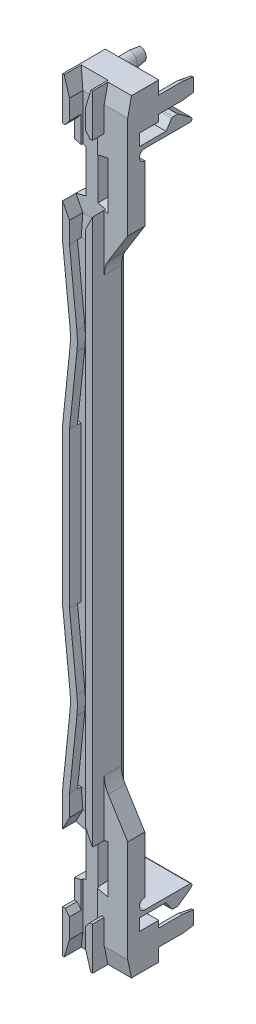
SolidWorks part; units mm, degrees
ref_plane "前视基准面" through (0, 0, 0) normal (0, 0, 1) x (1, 0, 0)
ref_plane "上视基准面" through (0, 0, 0) normal (0, 1, 0) x (1, 0, 0)
ref_plane "右视基准面" through (0, 0, 0) normal (1, 0, 0) x (0, 0, -1)
sketch "草图1" plane through (0, 0, 0) normal (0, 0, 1) x (1, 0, 0)
  line L0 (3.4, 59.5) -> (-6.6, 59.5) construction
  line L1 (-0.25, -0.4) -> (-0.25, 8.6)
  line L2 (-2.45, 110.9) -> (-2.45, 118.9)
  line L4 (3.4, 108.6) -> (3.4, 131)
  line L5 (-4.7, 110.9) -> (-4.7, 118.9)
  line L6 (-6.6, 131) -> (-6.6, 119.4)
  line L7 (-1, 101.5) -> (3.4, 108.6)
  line L8 (-0.25, 110.4) -> (-2.45, 110.9)
  line L9 (-6.6, 110.4) -> (-4.7, 110.9)
  line L10 (-6.6, 119.4) -> (-4.7, 118.9)
  line L11 (-0.25, 119.4) -> (-2.45, 118.9)
  line L13 (-0.25, 119.4) -> (-0.25, 110.4)
  line L26 (3.4, -12) -> (-6.6, -12)
  line L27 (-0.25, -0.4) -> (-2.45, 0.1)
  line L28 (-6.6, -0.4) -> (-4.7, 0.1)
  line L29 (-6.6, 8.6) -> (-4.7, 8.1)
  line L30 (-0.25, 8.6) -> (-2.45, 8.1)
  line L31 (-1, 17.5) -> (3.4, 10.4)
  line L32 (-6.6, -12) -> (-6.6, -0.4)
  line L33 (-6.6, 8.6) -> (-6.6, 110.4)
  line L34 (-4.7, 8.1) -> (-4.7, 0.1)
  line L35 (-1, 101.5) -> (-1, 17.5)
  line L37 (3.4, 10.4) -> (3.4, -12)
  line L39 (-2.45, 8.1) -> (-2.45, 0.1)
  line L40 (3.4, 131) -> (-6.6, 131)
  point P12 (-1, 59.5)
  dimension "D2" = 11.6
  dimension "D3" = 10
  dimension "D4" = 22.4
  dimension "D5" = 143
  dimension "D6" = 11.6
  dimension "D7" = 9
  dimension "D8" = 10
  dimension "D9" = 8
  dimension "D10" = 6.35
  dimension "D11" = 9
  dimension "D12" = 2.2
  dimension "D13" = 2.25
  dimension "D14" = 8
  dimension "D15" = 29.5
  dimension "D16" = 5.6
extrude "凸台-拉伸1" add sketch "草图1" against normal blind 5.8
sketch "草图2" plane through (-6.6, 0, 0) normal (-1, 0, 0) x (0, 0, 1)
  line L1 (-5.8, 110.9) -> (-4, 110.9)
  line L2 (-5.8, 110.9) -> (-5.8, 8.1)
  line L3 (-5.8, 8.1) -> (-4, 8.1)
  line L4 (-4, 110.9) -> (-4, 8.1)
  line L6 (-5.8, 8.1) -> (0, 8.1) construction
  line L7 (-5.8, 118.9) -> (-5.8, 110.9) construction
  line L8 (-5.8, 110.9) -> (0, 110.9) construction
  dimension "D1" = 1.8
extrude "切除-拉伸1" cut sketch "草图2" against normal up to surface (1.9 mm away)
sketch "草图3" plane through (3.4, 0, 0) normal (1, 0, 0) x (0, 0, -1)
  line L0 (0, 59.5) -> (5.8, 59.5) construction
  line L1 (0, 17.5) -> (0, 101.5) construction
  line L2 (5.8, 17.5) -> (5.8, 101.5) construction
  line L3 (5.8, 121.2) -> (3.2, 121.2)
  line L5 (5.8, 119.2) -> (3.2, 119.2)
  line L6 (5.8, 121.2) -> (5.8, 119.2)
  line L7 (5.8, 124.2) -> (2.2, 124.2)
  line L8 (5.8, 122.2) -> (2.2, 122.2)
  line L9 (5.8, 124.2) -> (5.8, 122.2)
  line L12 (2.2, -1.2) -> (2.2, -2.0165) construction
  line L13 (2.2, -5.2) -> (2.2, -3.2)
  line L14 (5.8, -5.2) -> (5.8, -3.2)
  line L15 (5.8, -3.2) -> (2.2, -3.2)
  line L16 (5.8, 108.6) -> (5.8, 131) construction
  line L18 (5.8, 131) -> (0, 131) construction
  line L19 (2.2, 124.2) -> (2.2, 122.2)
  line L21 (2.2, 120.2) -> (2.2, 121.0165) construction
  line L22 (5.8, -5.2) -> (2.2, -5.2)
  line L23 (5.8, -2.2) -> (5.8, -0.2)
  line L24 (5.8, -0.2) -> (3.2, -0.2)
  line L25 (5.8, -2.2) -> (3.2, -2.2)
  arc A0 (3.2, 121.2) -> (3.2, 119.2) centre (3.2, 120.2) ccw
  arc A1 (3.2, -2.2) -> (3.2, -0.2) centre (3.2, -1.2) cw
  dimension "D3" = 2
  dimension "D4" = 1
  dimension "D5" = 3.6
  dimension "D7" = 3.6
  dimension "D1" = 6.8
  dimension "D2" = 2
  dimension "D6" = 2
  dimension "D9" = 1
extrude "切除-拉伸2" cut sketch "草图3" against normal through all
sketch "草图4" plane through (3.4, 0, 0) normal (1, 0, 0) x (0, 0, -1)
  line L1 (3.2, 121.2) -> (5.8, 121.2)
  line L2 (3.2, 121.2) -> (3.2, -2.2)
  line L3 (3.2, -2.2) -> (5.8, -2.2)
  line L4 (5.8, 121.2) -> (5.8, -2.2)
  line L5 (5.8, 108.6) -> (5.8, 119.2) construction
  line L8 (5.8, 121.2) -> (3.2, 121.2) construction
  line L9 (3.2, -2.2) -> (5.8, -2.2) construction
  dimension "D1" = 2.6
extrude "切除-拉伸3" cut sketch "草图4" against normal blind 10
sketch "草图5" plane through (0, 0, -5.8) normal (0, 0, -1) x (-1, 0, 0)
  line L0 (-3.4, 131) -> (6.6, 131) construction
  line L1 (1, 59.5) -> (6.6, 59.5) construction
  line L2 (1, 101.5) -> (1, 17.5) construction
  line L4 (-3.4, 128.5479) -> (-3.4, 125.4521)
  line L6 (6.6, 128.5479) -> (6.6, 125.4521)
  line L8 (6.6, -9.5479) -> (6.6, -6.4521)
  line L9 (-3.4, -9.5479) -> (-3.4, -6.4521)
  line L12 (-3.4, 124.2) -> (-3.4, 131) construction
  line L14 (6.6, -5.2) -> (6.6, -12) construction
  circle A0 centre (1.6, 127) radius 1.55
  arc A1 (6.6, 128.5479) -> (6.6, 125.4521) centre (6.68, 127) ccw
  arc A2 (-3.4, 125.4521) -> (-3.4, 128.5479) centre (-3.48, 127) ccw
  arc A3 (-3.4, -6.4521) -> (-3.4, -9.5479) centre (-3.48, -8) cw
  arc A4 (6.6, -9.5479) -> (6.6, -6.4521) centre (6.68, -8) cw
  circle A5 centre (1.6, -8) radius 1.55
  point P2 (1.6, 131)
  dimension "D1" = 0
  dimension "D2" = 67.5
  dimension "D3" = 3.1
  dimension "D4" = 0
  dimension "D5" = 0
  dimension "D6" = 5.08
  dimension "D7" = 5.08
  dimension "D8" = 1.55
  dimension "D9" = 1.55
extrude "凸台-拉伸2" add sketch "草图5" along normal blind 6.5
chamfer "倒角1" distance 2 distance2 0.3 4 edges at (-5.13, -8, -12.3) (1.93, -8, -12.3) (-5.13, 127, -12.3) (1.93, 127, -12.3)
sketch "草图6" plane through (0, 0, -12.3) normal (0, 0, -1) x (-1, 0, 0)
  circle A0 centre (1.6, 127) radius 1.55
  circle A1 centre (1.6, -8) radius 1.55
  dimension "D1" = 3.1
  dimension "D2" = 3.1
extrude "切除-拉伸4" cut sketch "草图6" against normal blind 4.5
sketch "草图7" plane through (0, 0, -7.8) normal (0, 0, -1) x (-1, 0, 0)
  circle A0 centre (1.6, 127) radius 1
  circle A1 centre (1.6, -8) radius 1
  dimension "D1" = 2
  dimension "D2" = 2
extrude "切除-拉伸5" cut sketch "草图7" against normal up to surface (2 mm away)
fillet "圆角1" radius 0.3 2 edges at (-3.15, -8, -7.8) (-3.15, 127, -7.8)
sketch "草图8" plane through (3.4, 0, 0) normal (-1, 0, 0) x (0, 0, 1)
  line L0 (-5.8, 122.2) -> (-7.3, 122.2)
  line L1 (-12, 121.2) -> (-5.8, 121.2)
  line L2 (-5.8, 122.2) -> (-5.8, 121.2)
  line L3 (-5.8, 121.2) -> (-5.8, 122.2) construction
  line L4 (-12, 121.2) -> (-12, 121.8)
  line L5 (-12, 121.8) -> (-9.4, 123.7)
  line L6 (-3.2, 59.5) -> (0, 59.5) construction
  line L7 (-5.8, -3.2) -> (-5.8, -2.2) construction
  line L8 (0, 110.4) -> (0, 8.6) construction
  line L9 (-12, -2.8) -> (-9.4, -4.7)
  line L10 (-12, -2.2) -> (-12, -2.8)
  line L11 (-2.2, 122.2) -> (-5.8, 122.2) construction
  line L12 (-5.8, -3.2) -> (-5.8, -2.2)
  line L13 (-5.8, -2.2) -> (-12, -2.2)
  line L14 (-5.8, -3.2) -> (-7.3, -3.2)
  line L15 (-5.8, 121.2) -> (-3.2, 121.2) construction
  line L17 (-5.8, 124.2) -> (-5.8, 125.4521) construction
  line L18 (-3.2, 101.5) -> (-3.2, 17.5) construction
  line L19 (-3.2, -2.2) -> (-5.8, -2.2) construction
  line L20 (-9.4, 123.7) -> (-8.3, 123.7)
  line L21 (-8.3, 123.7) -> (-7.3, 122.2)
  line L23 (0, 108.6) -> (0, 131) construction
  line L24 (-8.3, -4.7) -> (-7.3, -3.2)
  line L25 (-9.4, -4.7) -> (-8.3, -4.7)
  dimension "D3" = 2.6
  dimension "D6" = 3.7
  dimension "D1" = 12
  dimension "D2" = 0.6
  dimension "D4" = 1.5
  dimension "D5" = 2.5
extrude "凸台-拉伸3" add sketch "草图8" along normal blind 10
sketch "草图9" plane through (0, 0, 0) normal (0, 0, 1) x (1, 0, 0)
  line L0 (-6.6, 131) -> (-6.3, 131)
  line L1 (3.4, 131) -> (-6.6, 131) construction
  line L2 (-6.6, 131) -> (-6.6, 123)
  line L3 (-6.6, 123) -> (-6.1, 123)
  line L4 (-6.1, 123) -> (-5.3, 124)
  line L5 (-5.3, 124) -> (-5.3, 127.7)
  line L6 (-6.3, 131) -> (-5.3, 127.7)
  line L7 (-1, 123) -> (-1.5, 123)
  line L8 (-1.3, 131) -> (-2.3, 127.7)
  line L9 (-2.3, 124) -> (-2.3, 127.7)
  line L10 (-1.5, 123) -> (-2.3, 124)
  line L11 (-1, 131) -> (-1, 123)
  line L12 (-6.6, 110.4) -> (-5.3, 107.9)
  line L13 (-1, -4) -> (-1.45, -4)
  line L15 (-6.6, 110.4) -> (-6.6, 8.6) construction
  line L16 (-2.45, 110.9) -> (-0.25, 110.4) construction
  line L17 (-6.6, 8.6) -> (-5.3, 11.1)
  line L18 (-2.3, 107.9) -> (-1, 110.5705)
  line L19 (-6.6, 59.5) -> (-1, 59.5) construction
  line L20 (-1, 17.5) -> (-1, 101.5) construction
  line L21 (-2.3, 11.1) -> (-1, 8.4295)
  line L22 (-0.25, 8.6) -> (-2.45, 8.1) construction
  line L23 (-1.45, -4) -> (-2.3, -5)
  line L24 (-6.6, -4) -> (-6.1, -4)
  line L25 (-1, 131) -> (-1.3, 131)
  line L26 (-3.85, -12) -> (-3.85, -4) construction
  line L27 (-1, -12) -> (-1.3, -12)
  line L28 (-1, -12) -> (-1, -4)
  line L29 (-6.1, -4) -> (-5.3, -5)
  line L30 (-2.3, -5) -> (-2.3, -8.7)
  line L31 (-1.3, -12) -> (-2.3, -8.7)
  line L32 (-6.3, -12) -> (-5.3, -8.7)
  line L33 (-5.3, -5) -> (-5.3, -8.7)
  line L34 (-6.6, -0.4) -> (-6.6, -12) construction
  line L35 (-5.3, 11.1) -> (-5.3, 107.9)
  line L36 (-2.3, 107.9) -> (-2.3, 11.1)
  line L37 (-1, 8.4295) -> (-1, 110.5705)
  line L38 (-6.6, 8.6) -> (-6.6, 110.4)
  line L39 (-11.8081, 91) -> (4.8238, 91) construction
  line L40 (3.4, 131) -> (-6.6, 131) construction
  line L41 (-6.6, -12) -> (-6.6, -4)
  line L42 (-6.6, -12) -> (-6.3, -12)
  line L43 (-1, 17.5) -> (-1, 101.5) construction
  line L44 (-6.6, 110.4) -> (-6.6, 8.6) construction
  dimension "D1" = 0.3
  dimension "D2" = 8
  dimension "D3" = 1.3
  dimension "D4" = 1
  dimension "D5" = 3.3
  dimension "D6" = 1.3
  dimension "D7" = 1.3
  dimension "D8" = 1.3
  dimension "D9" = 3
  dimension "D10" = 2.5
  dimension "D11" = 0.3
  dimension "D12" = 1.3
  dimension "D16" = 40
  dimension "D18" = 3.3
  dimension "D19" = 1
  dimension "D20" = 0.5
  dimension "D21" = 0.5
extrude "凸台-拉伸5" add sketch "草图9" along normal blind 2.2
sketch "草图10" plane through (0, 0, 2.2) normal (0, 0, 1) x (1, 0, 0)
  line L0 (-6.6, 110.4) -> (-6.6, 8.6) construction
  line L1 (-1.3, 131) -> (-6.3, 131) construction
  line L2 (-6.3, -12) -> (-1.3, -12) construction
  line L3 (-6.6, 104) -> (-5.3, 104)
  line L4 (-6.6, 104) -> (-6.6, 74)
  line L5 (-6.6, 74) -> (-5.3, 74)
  line L6 (-5.3, 104) -> (-5.3, 74)
  line L10 (-5.3, 15) -> (-5.3, 45)
  line L11 (-6.6, 45) -> (-5.3, 45)
  line L12 (-6.6, 15) -> (-6.6, 45)
  line L13 (-6.6, 15) -> (-5.3, 15)
  dimension "D1" = 1.3
  dimension "D2" = 30
  dimension "D3" = 27
  dimension "D4" = 27
  dimension "D5" = 30
  dimension "D6" = 1.3
  dimension "D7" = 1.3
extrude "切除-拉伸6" cut sketch "草图10" against normal up to surface (2.2 mm away)
sketch "草图11" plane through (0, 0, 2.2) normal (0, 0, 1) x (1, 0, 0)
  line L1 (-6.6, 104) -> (-5.2, 90.5533)
  line L2 (-5.2, 87.4467) -> (-6.6, 74)
  line L3 (-5.3, 104) -> (-3.9139, 90.6872)
  line L4 (-6.6, 104) -> (-5.3, 104)
  line L5 (-3.9139, 87.3128) -> (-5.3, 74)
  line L6 (-6.6, 74) -> (-5.3, 74)
  line L7 (-6.6, 45) -> (-5.3, 45)
  line L8 (-3.9139, 87.3128) -> (-5.3139, 73.8661) construction
  line L9 (-6.6, 59.5) -> (-1, 59.5) construction
  line L10 (-6.6, 74) -> (-6.6, 45) construction
  line L11 (-5.3139, 104.1339) -> (-3.9139, 90.6872) construction
  line L12 (-6.6, 104) -> (-6.6, 74) construction
  line L13 (-3.9139, 31.6872) -> (-5.3, 45)
  line L14 (-6.6, 15) -> (-5.3, 15)
  line L15 (-5.3, 15) -> (-3.9139, 28.3128)
  line L16 (-5.2, 31.5533) -> (-6.6, 45)
  line L17 (-6.6, 15) -> (-5.2, 28.4467)
  arc A0 (-5.2, 90.5533) -> (-5.2, 87.4467) centre (-20.1194, 89) cw
  arc A1 (-3.9139, 90.6872) -> (-3.9139, 87.3128) centre (-20.1194, 89) cw
  arc A2 (-3.9139, 28.3128) -> (-3.9139, 31.6872) centre (-20.1194, 30) ccw
  arc A3 (-5.2, 28.4467) -> (-5.2, 31.5533) centre (-20.1194, 30) ccw
  point P10 (-5.0383, 89)
  point P19 (-5.0383, 30)
  dimension "D3" = 15
  dimension "D1" = 15
  dimension "D2" = 1.4
extrude "凸台-拉伸6" add sketch "草图11" against normal blind 1.5
sketch "草图12" plane through (-4.7, 0, 0) normal (-1, 0, 0) x (0, 0, 1)
  line L1 (-3.2, 119.2) -> (-5.2, 119.2)
  line L2 (-3.2, 119.2) -> (-3.2, -0.2)
  line L3 (-3.2, -0.2) -> (-5.2, -0.2)
  line L4 (-5.2, 119.2) -> (-5.2, -0.2)
  line L5 (0, 8.1) -> (0, 0.1) construction
  line L6 (-3.2, -2.2) -> (-12, -2.2) construction
  line L8 (-12, 121.2) -> (-3.2, 121.2) construction
  dimension "D1" = 5.2
  dimension "D2" = 2
  dimension "D3" = 2
  dimension "D4" = 2
extrude "凸台-拉伸7" add sketch "草图12" against normal up to surface (2.25 mm away)
fillet "圆角2" radius 2 1 edges at (-6.6, 59.5, -3.2)
fillet "圆角3" radius 5 2 edges at (-1, 101.5, -1.6) (-1, 17.5, -1.6)
fillet "圆角7" radius 0.2 1 edges at (-4.7, 59.5, -5.2)
fillet "圆角9" radius 0.2 1 edges at (-2.45, 59.5, -5.2)
fillet "圆角10" radius 0.2 5 edges at (-2.45, 119.2, -4.1) (-4.7, 119.2, -4.1) (-4.6414, 119.2, -5.1414) (-3.575, 119.2, -5.2) (-2.5086, 119.2, -5.1414)
fillet "圆角11" radius 0.2 5 edges at (-3.575, -0.2, -5.2) (-2.45, -0.2, -4.1) (-4.7, -0.2, -4.1) (-4.6414, -0.2, -5.1414) (-2.5086, -0.2, -5.1414)
fillet "圆角5" [suppressed] radius 1
sketch "草图18" plane through (0, 0, -5.8) normal (0, 0, -1) x (-1, 0, 0)
  line L1 (0.6, 130.4) -> (6.6, 130.4)
  line L2 (0.6, 130.4) -> (0.6, 128.8)
  line L3 (0.6, 128.8) -> (6.6, 128.8)
  line L4 (6.6, 130.4) -> (6.6, 128.8)
  line L5 (-3.4, 131) -> (6.6, 131) construction
  line L7 (6.6, 59.5) -> (1, 59.5) construction
  line L8 (6.6, 110.4) -> (6.6, 8.6) construction
  line L9 (1, 100.0763) -> (1, 18.9237) construction
  line L10 (6.6, -11.4) -> (6.6, -9.8)
  line L11 (0.6, -9.8) -> (6.6, -9.8)
  line L12 (0.6, -11.4) -> (0.6, -9.8)
  line L13 (0.6, -11.4) -> (6.6, -11.4)
  line L14 (6.6, 131) -> (6.6, 128.5479) construction
  line L15 (-3.4, 128.5479) -> (-3.4, 131) construction
  dimension "D1" = 1.6
  dimension "D2" = 2.2
  dimension "D3" = 4
extrude "切除-拉伸10" cut sketch "草图18" against normal blind 0.75
fillet "圆角6" radius 0.8 4 edges at (-3.6, 128.8, -5.05) (-3.6, 130.4, -5.05) (-3.6, -9.8, -5.05) (-3.6, -11.4, -5.05)
sketch "草图30" plane through (0, 0, 0) normal (0, 0, 1) x (1, 0, 0)
  line L0 (-1.3, 131) -> (-6.3, 131) construction
  line L1 (-5.3, 127.7) -> (-6.3, 131) construction
  line L2 (-5.3, 124) -> (-5.3, 127.7) construction
  line L3 (-1.3, 131) -> (-2.3, 127.7) construction
  line L4 (-2.3, 127.7) -> (-2.3, 124) construction
  line L5 (-4.7, 110.9) -> (-6.6, 110.4) construction
  line L6 (-5.3, 107.9) -> (-6.6, 110.4) construction
  line L7 (-5.3, 104) -> (-5.3, 107.9) construction
  line L8 (-2.3, 107.9) -> (-2.3, 11.1) construction
  line L10 (-2.45, 110.9) -> (-1, 110.5705) construction
  line L11 (-1, 59.5) -> (-8.6371, 59.5) construction
  line L12 (-5.3, 11.1) -> (-6.6, 8.6)
  line L13 (-6.6, 8.6) -> (-5.3, 11.1) construction
  line L14 (-1, 8.4295) -> (-1, 110.5705) construction
  line L15 (-6.6, 8.6) -> (-4.7, 8.1) construction
  line L16 (-6.6, 8.6) -> (-4.7, 8.1) construction
  line L17 (-2.3, -8.7) -> (-1.3, -12)
  line L18 (-2.3, 8.1341) -> (-1, 8.4295)
  line L19 (-2.3, 8.1341) -> (-2.3, -8.7)
  line L20 (-5.3, 8.2579) -> (-5.3, -8.7)
  line L21 (-1.3, -12) -> (-6.3, -12)
  line L22 (-1, 8.4295) -> (-2.3, 11.1)
  line L23 (-2.3, 11.1) -> (-2.3, 15)
  line L24 (-2.3, 15) -> (-5.3, 15)
  line L25 (-5.3, 15) -> (-5.3, 11.1)
  line L26 (-6.3, 131) -> (-5.3, 127.7)
  line L27 (-6.6, 110.4) -> (-5.3, 110.7421)
  line L28 (-5.3, 107.9) -> (-6.6, 110.4)
  line L29 (-5.3, 104) -> (-5.3, 107.9)
  line L30 (-2.3, 104) -> (-5.3, 104)
  line L31 (-2.3, 107.9) -> (-2.3, 104)
  line L32 (-1, 110.5705) -> (-2.3, 107.9)
  line L33 (-1.3, 131) -> (-6.3, 131)
  line L34 (-5.3, 110.7421) -> (-5.3, 127.7)
  line L35 (-2.3, 110.8659) -> (-2.3, 127.7)
  line L36 (-2.3, 110.8659) -> (-1, 110.5705)
  line L37 (-2.3, 127.7) -> (-1.3, 131)
  line L38 (-1, 110.5705) -> (-2.3, 107.9) construction
  line L39 (-6.6, 8.6) -> (-5.3, 8.2579)
  line L40 (-6.3, -12) -> (-5.3, -8.7)
extrude "切除-拉伸15" cut sketch "草图30" against normal blind 0.3
chamfer "倒角3" distance 0.7 distance2 3.3 2 edges at (1.2, -12, 0)
chamfer "倒角4" distance 0.7 distance2 3.3 2 edges at (-3.8, 131, -0.3) (-3.8, -12, -0.3)
sketch "草图22" plane through (3.4, 0, 0) normal (1, 0, 0) x (0, 0, -1)
  line L0 (7.3, 122.2) -> (7.1667, 122)
  line L1 (2.2, 122.2) -> (7.3, 122.2)
  line L2 (2.2, 122.2) -> (2.2, 122)
  line L3 (2.2, 122) -> (7.1667, 122)
  line L4 (7.3, -3.2) -> (7.1667, -3)
  line L5 (2.2, -3.2) -> (7.3, -3.2)
  line L6 (2.2, -3.2) -> (2.2, -3)
  line L7 (2.2, -3) -> (7.1667, -3)
  line L8 (8.3, -4.7) -> (7.3, -3.2) construction
  line L9 (7.3, 122.2) -> (8.3, 123.7) construction
  dimension "D1" = 0.2
  dimension "D2" = 0.2
extrude "切除-拉伸11" cut sketch "草图22" against normal up to surface (10 mm away)
sketch "草图23" plane through (0, 0, -3.2) normal (0, 0, -1) x (-1, 0, 0)
  line L0 (-2.4, 119.2) -> (-2.4, 109.2) construction
  line L1 (0.25, 119.2) -> (-3.4, 119.2) construction
  line L2 (-3.4, 119.2) -> (-3.4, 108.6) construction
  text T0 "RDEKONO" font "黑体" height 1.5
  dimension "D1" = 1
  dimension "D2" = 10
extrude "切除-拉伸12" cut sketch "草图23" against normal blind 0.2
fillet "圆角12" radius 0.3 4 edges at (-1.6, -4.7, -8.3) (-1.6, -4.7, -9.4) (-1.6, -2.8, -12) (-1.6, -2.2, -12)
ref_plane "基准面1" through (0, 118.9, 0) normal (0, 1, 0) x (1, 0, 0)
sketch "草图24" plane through (0, 118.9, 0) normal (0, 1, 0) x (1, 0, 0)
  line L0 (-4.7, 2.7) -> (-4.7, 4)
  line L1 (-4.7, 3.2) -> (-4.7, 0.3) construction
  line L2 (-4.7, 4) -> (-5.2, 4)
  line L3 (-5.2, 4) -> (-4.7, 2.7)
  dimension "D1" = 0.5
  dimension "D2" = 1.3
  dimension "D3" = 3.7
extrude "凸台-拉伸9" add sketch "草图24" against normal up to surface (7.4079 mm away)
sketch "草图25" plane through (0, 0, -4) normal (0, 0, -1) x (-1, 0, 0)
  line L0 (4.7, 110.9) -> (4.7, 118.9) construction
  line L1 (5.7466, 117.4) -> (4.7, 117.4)
  line L2 (5.7466, 117.4) -> (5.7466, 112.4)
  line L3 (5.7466, 112.4) -> (4.7, 112.4)
  line L4 (4.7, 117.4) -> (4.7, 112.4)
  line L5 (5.7466, 114.9) -> (4.7, 114.9) construction
  dimension "D1" = 2.5
  dimension "D2" = 4
extrude "切除-拉伸13" cut sketch "草图25" against normal blind 10
ref_plane "基准面2" through (-3.575, 0, 0) normal (-1, 0, 0) x (0, 0, 1)
mirror "镜向1" about plane through (-3.575, 0, 0) normal (-1, 0, 0) of "切除-拉伸13", "凸台-拉伸9"
sketch "草图26" plane through (0, 112.4, 0) normal (0, 1, 0) x (1, 0, 0)
  line L0 (-2.45, 2.7) -> (-2.45, 4)
  line L1 (-2.45, 4) -> (-1.95, 4)
  line L2 (-1.95, 4) -> (-2.45, 2.7)
extrude "凸台-拉伸10" add sketch "草图26" against normal up to surface (1.6136 mm away)
ref_plane "基准面3" through (0, 0.1, 0) normal (0, -1, 0) x (-1, 0, 0)
sketch "草图27" plane through (0, 0.1, 0) normal (0, -1, 0) x (-1, 0, 0)
  line L0 (4.7, 2.7) -> (4.7, 4)
  line L1 (4.7, 4) -> (5.2, 4)
  line L2 (5.2, 4) -> (4.7, 2.7)
  line L3 (4.7, 3.2) -> (4.7, 0.3) construction
  dimension "D1" = 0.5
  dimension "D2" = 1.3
  dimension "D3" = 3.7
extrude "凸台-拉伸11" add sketch "草图27" against normal up to vertex (8.1316 mm away)
sketch "草图28" plane through (0, 0, -4) normal (0, 0, -1) x (-1, 0, 0)
  line L0 (4.7, 8.1) -> (4.7, 0.1) construction
  line L1 (5.8739, 6.6) -> (4.7, 6.6)
  line L2 (5.8739, 6.6) -> (5.8739, 1.6)
  line L3 (5.8739, 1.6) -> (4.7, 1.6)
  line L4 (4.7, 6.6) -> (4.7, 1.6)
  line L5 (5.8739, 4.1) -> (4.7, 4.1) construction
  dimension "D1" = 2.5
  dimension "D2" = 4
extrude "切除-拉伸14" cut sketch "草图28" against normal blind 10
mirror "镜向2" about plane through (-3.575, 0, 0) normal (-1, 0, 0) of "切除-拉伸14", "凸台-拉伸11"
fillet "圆角13" radius 0.1 8 edges at (-5.2, 0.85, -4) (-5.2, 7.35, -4) (-1.95, 0.85, -4) (-1.95, 7.35, -4) (-1.95, 111.5932, -4) (-1.95, 118.15, -4) (-5.2, 111.5842, -4) (-5.2, 118.15, -4)
sketch "草图34" plane through (-5.3, 0, 0) normal (1, 0, 0) x (0, 0, -1)
  line L0 (0.3, 104) -> (0, 104)
  line L1 (0, 104) -> (0.3, 107.9)
  line L2 (0.3, 107.9) -> (0.3, 104)
  line L3 (-2.2, 59.5) -> (5, 59.5) construction
  line L4 (-2.2, 8.4295) -> (-2.2, 110.5705) construction
  line L5 (5, 0) -> (5, 119) construction
  line L6 (0.3, 11.1) -> (0.3, 15)
  line L7 (0, 15) -> (0.3, 11.1)
  line L8 (0.3, 15) -> (0, 15)
extrude "凸台-拉伸12" add sketch "草图34" along normal up to surface (3 mm away)
fillet "圆角14" radius 0.3 4 edges at (-1.6, 121.2, -12) (-1.6, 121.8, -12) (-1.6, 123.7, -9.4) (-1.6, 123.7, -8.3)
